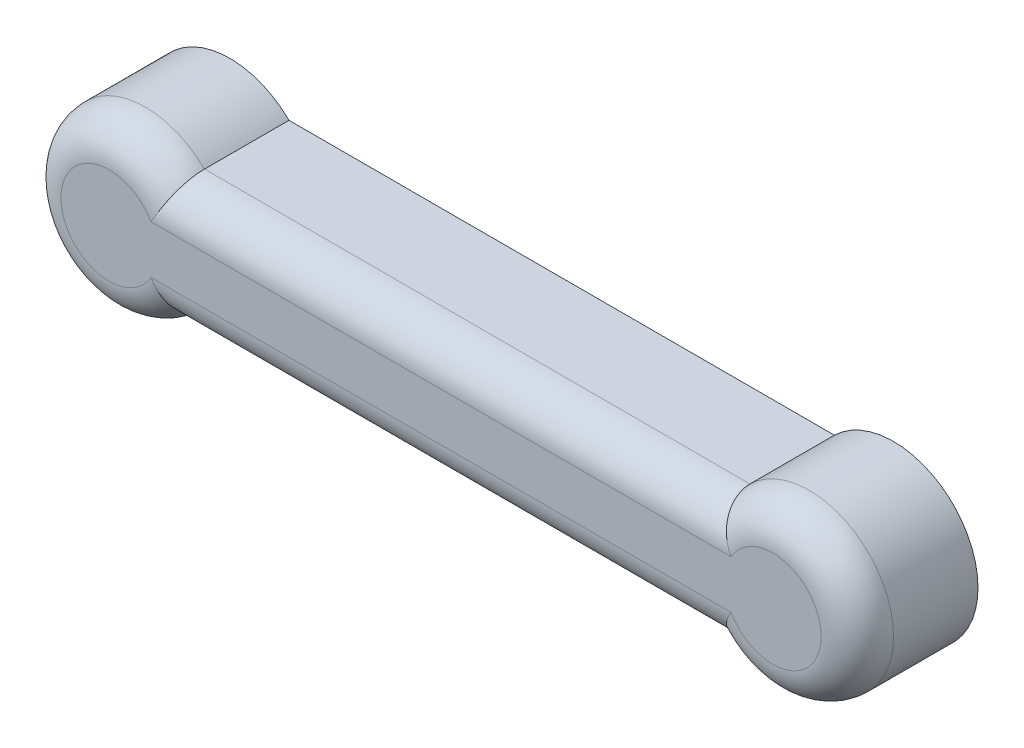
SolidWorks part; units mm, degrees
ref_plane "Front" through (0, 0, 0) normal (0, 0, 1) x (1, 0, 0)
ref_plane "Top" through (0, 0, 0) normal (0, 1, 0) x (1, 0, 0)
ref_plane "Right" through (0, 0, 0) normal (1, 0, 0) x (0, 0, -1)
sketch "Sketch1" plane through (0, 0, 0) normal (0, 0, 1) x (1, 0, 0)
  line L0 (0, 56.4249) -> (0, -43.4161) construction
  line L1 (-68.5522, 0) -> (70.439, 0) construction
  line L2 (-22.601, 5) -> (22.601, 5)
  line L3 (-22.601, -5) -> (22.601, -5)
  arc A0 (-22.601, 5) -> (-22.601, -5) centre (-27.5, 0) ccw
  arc A1 (22.601, 5) -> (22.601, -5) centre (27.5, 0) cw
  dimension "D1" = 14
  dimension "D2" = 55
  dimension "D3" = 10
extrude "Boss-Extrude1" add sketch "Sketch1" along normal blind 10
sketch "Sketch2" plane through (0, 0, 0) normal (0, 0, -1) x (-1, 0, 0)
  circle A0 centre (-27.5, 0) radius 4.2
  circle A1 centre (27.5, 0) radius 4.2
  dimension "D1" = 8.4
extrude "Cut-Extrude1" cut sketch "Sketch2" against normal blind 8
fillet "Fillet1" radius 3 4 edges at (0, 5, 10) (34.5, 0, 10) (0, -5, 10) (-34.5, 0, 10)
